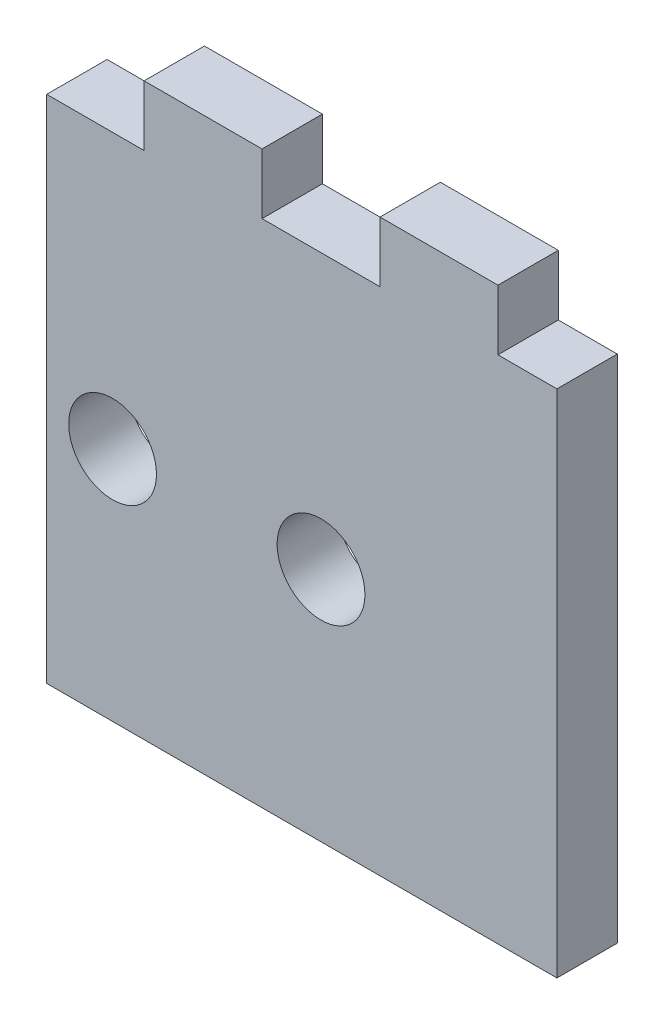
SolidWorks part; units mm, degrees
ref_plane "Front Plane" through (0, 0, 0) normal (0, 0, 1) x (1, 0, 0)
ref_plane "Top Plane" through (0, 0, 0) normal (0, 1, 0) x (1, 0, 0)
ref_plane "Right Plane" through (0, 0, 0) normal (1, 0, 0) x (0, 0, -1)
sketch "Sketch2" plane through (0, 0, 0) normal (0, 0, 1) x (1, 0, 0)
  line L4 (-46.5, 0) -> (-46.5, 46.5) construction
  line L13 (-43, 0) -> (0, 0)
  line L22 (0, 46.5) -> (0, 0) construction
  line L23 (-16.125, 46.5) -> (-26.875, 46.5)
  line L24 (-26.875, 46.5) -> (-26.875, 52)
  line L28 (-46.5, 0) -> (-43, 0)
  line L29 (-26.875, 52) -> (-37.625, 52)
  line L30 (-37.625, 52) -> (-37.625, 46.5)
  line L31 (-37.625, 46.5) -> (-46.5, 46.5)
  line L32 (-46.5, 46.5) -> (-46.5, 0)
  line L33 (-16.125, 46.5) -> (-16.125, 52)
  line L34 (-16.125, 52) -> (-5.375, 52)
  line L35 (-5.375, 52) -> (-5.375, 46.5)
  line L36 (-5.375, 46.5) -> (0, 46.5)
  line L37 (0, 46.5) -> (0, 0)
  circle A0 centre (-21.5, 21.5) radius 4
  circle A5 centre (-40.5, 21.5) radius 4
  point P10 (-21.5, 46.5)
  dimension "D3" = 8
  dimension "D11" = 8
  dimension "D13" = 10.75
  dimension "D2" = 10.75
  dimension "D8" = 3.5
  dimension "D9" = 19
  dimension "D10" = 43
  dimension "D12" = 10.75
  dimension "D14" = 46.5
  dimension "D15" = 5.375
  dimension "D16" = 8.875
  dimension "D17" = 5.5
extrude "Boss-Extrude1" add sketch "Sketch2" along normal blind 5.5
